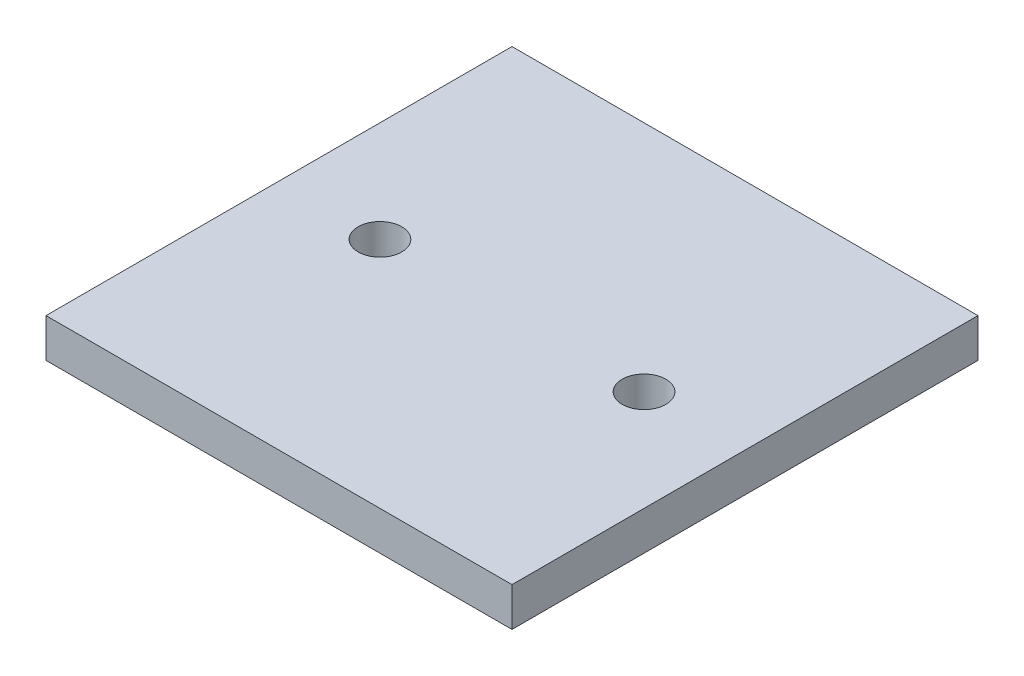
SolidWorks part; units mm, degrees
ref_plane "Front Plane" through (0, 0, 0) normal (0, 0, 1) x (1, 0, 0)
ref_plane "Top Plane" through (0, 0, 0) normal (0, 1, 0) x (1, 0, 0)
ref_plane "Right Plane" through (0, 0, 0) normal (1, 0, 0) x (0, 0, -1)
sketch "Sketch1" plane through (0, 0, 0) normal (0, 1, 0) x (1, 0, 0)
  line L1 (-76.2, 76.2) -> (76.2, 76.2)
  line L2 (-76.2, 76.2) -> (-76.2, -76.2)
  line L3 (-76.2, -76.2) -> (76.2, -76.2)
  line L4 (76.2, 76.2) -> (76.2, -76.2)
  point P4 (0, 76.2)
  point P6 (-76.2, 0)
  dimension "D1" = 152.4
  dimension "D2" = 152.4
extrude "Boss-Extrude1" add sketch "Sketch1" along normal blind 12.7
sketch "Sketch2" plane through (0, 0, 0) normal (0, 1, 0) x (1, 0, 0)
  circle A0 centre (-43.18, 0) radius 7.1437
  circle A1 centre (43.18, 0) radius 7.1437
  dimension "D3" = 14.2875
  dimension "D4" = 14.2875
  dimension "D1" = 43.18
  dimension "D2" = 43.18
extrude "Cut-Extrude1" cut sketch "Sketch2" along normal blind 25.4
